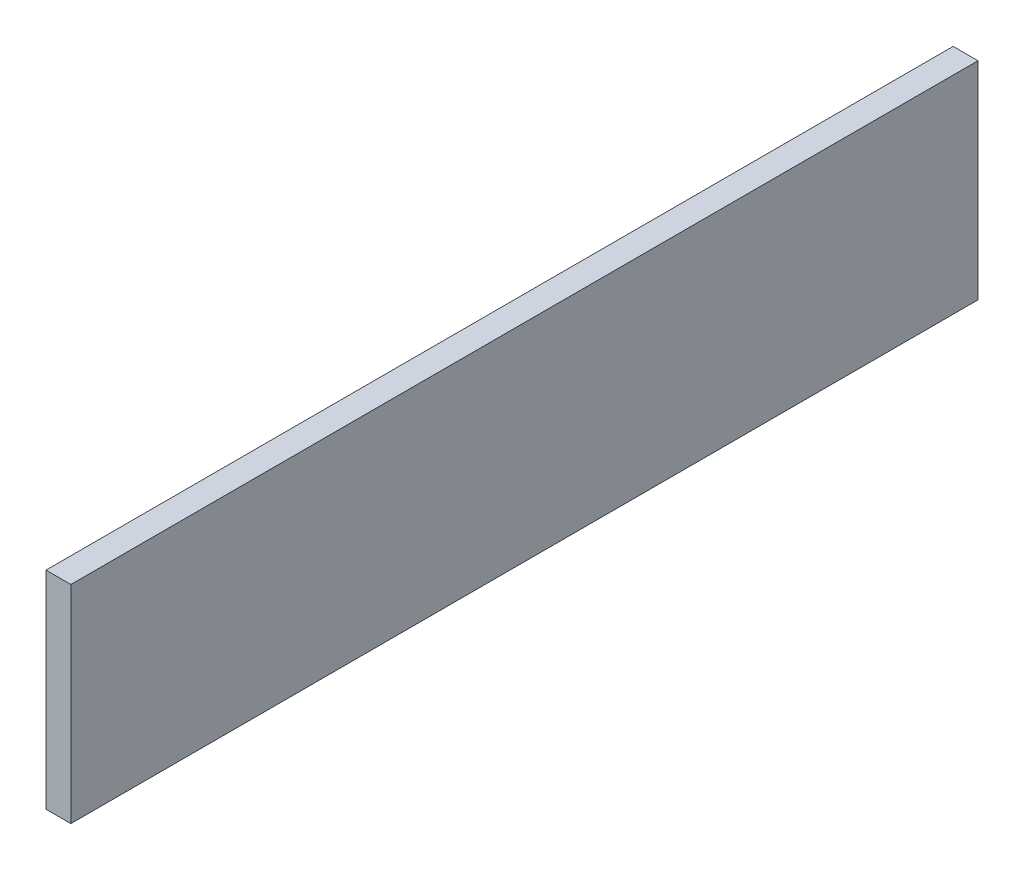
SolidWorks part; units mm, degrees
ref_plane "Front Plane" through (0, 0, 0) normal (0, 0, 1) x (1, 0, 0)
ref_plane "Top Plane" through (0, 0, 0) normal (0, 1, 0) x (1, 0, 0)
ref_plane "Right Plane" through (0, 0, 0) normal (1, 0, 0) x (0, 0, -1)
sketch "Sketch1" plane through (0, 0, 0) normal (1, 0, 0) x (0, 0, -1)
  line L1 (0, 0) -> (111.252, 0)
  line L2 (0, 0) -> (0, 25.4)
  line L3 (0, 25.4) -> (111.252, 25.4)
  line L4 (111.252, 0) -> (111.252, 25.4)
  dimension "D1" = 25.4
  dimension "D2" = 111.252
extrude "Boss-Extrude1" add sketch "Sketch1" along normal blind 3.048
